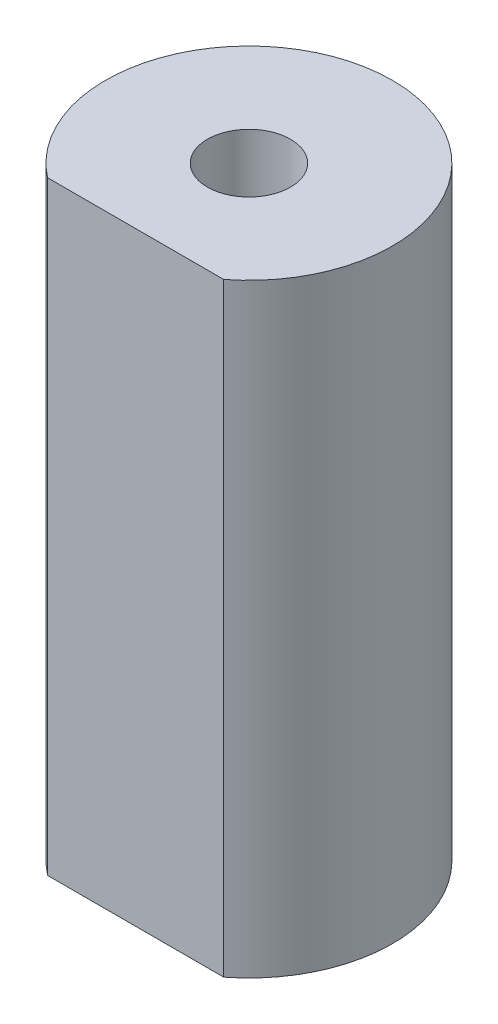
SolidWorks part; units mm, degrees
ref_plane "Front" through (0, 0, 0) normal (0, 0, 1) x (1, 0, 0)
ref_plane "Top" through (0, 0, 0) normal (0, 1, 0) x (1, 0, 0)
ref_plane "Right" through (0, 0, 0) normal (1, 0, 0) x (0, 0, -1)
sketch "Sketch3" plane through (0, 0, 0) normal (0, 1, 0) x (1, 0, 0)
  line L1 (5.831, -7.5) -> (-5.831, -7.5)
  arc A0 (5.831, -7.5) -> (-5.831, -7.5) centre (0, 0) ccw
  circle A1 centre (0, 0) radius 2.75
extrude "Extrude1" add sketch "Sketch3" along normal blind 40
